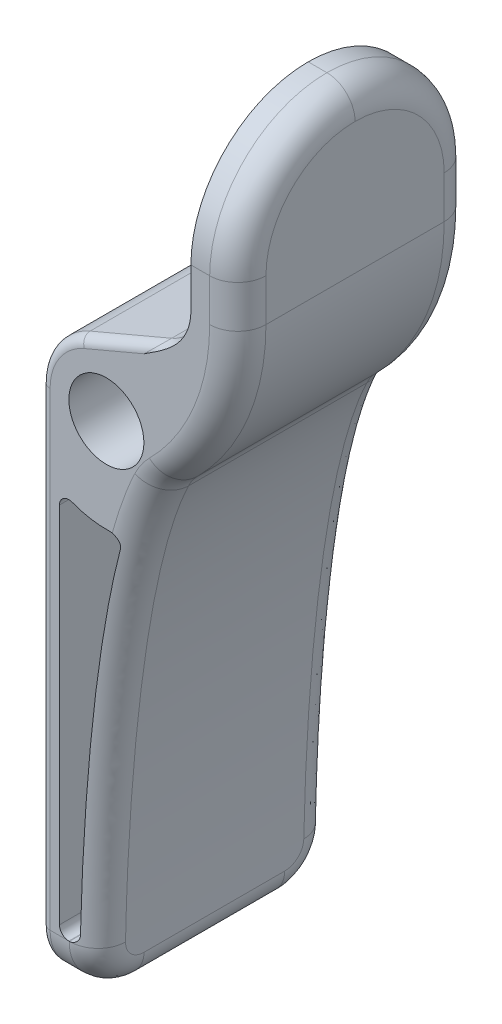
SolidWorks part; units mm, degrees
ref_plane "Front Plane" through (0, 0, 0) normal (0, 0, 1) x (1, 0, 0)
ref_plane "Top Plane" through (0, 0, 0) normal (0, 1, 0) x (1, 0, 0)
ref_plane "Right Plane" through (0, 0, 0) normal (1, 0, 0) x (0, 0, -1)
sketch "Sketch1" plane through (0, 0, 0) normal (0, 0, 1) x (1, 0, 0)
  line L0 (-10.989, -13.3266) -> (-22.7311, -18.3022)
  line L4 (-10.989, -5) -> (-10.989, 5)
  line L5 (-10.989, -13.3266) -> (-10.989, 6.6734)
  line L6 (-5.989, 6.6734) -> (-5.989, -20.9421)
  line L7 (-5.989, -20.9421) -> (-13.8327, -28.5221)
  line L8 (-27, -24.7474) -> (-27, -79.7474)
  line L9 (-27, -79.7474) -> (-21, -79.7474)
  line L11 (-10.989, 6.6734) -> (-5.989, 6.6734)
  circle A0 centre (-20, -24.7474) radius 4 construction
  circle A1 centre (-20, -24.7474) radius 4
  arc A2 (-22.7311, -18.3022) -> (-27, -24.7474) centre (-20, -24.7474) ccw
  circle A4 centre (-20, -24.7474) radius 7 construction
  spline S0 degree 3 poles (-13.8327, -28.5221) (-19.4669, -39.1393) (-21, -66.2952) (-21, -79.1069) (-21, -79.7474) knots 0 0 0 0 0.95 1 1 1 1
  dimension "D2" = 1
  dimension "D3" = 5
  dimension "D4" = 6
  dimension "D5" = 20
  dimension "D6" = 55
  dimension "D1" = 3
extrude "Boss-Extrude1" add sketch "Sketch1" along normal mid plane 25
fillet "Fillet1" radius 25 1 edges at (-5.989, -20.9421, 0)
fillet "Fillet2" radius 5 2 edges at (-24, -79.7474, -12.5) (-24, -79.7474, 12.5)
sketch "Sketch3" plane through (0, 0, 12.5) normal (0, 0, 1) x (1, 0, 0)
  line L9 (-22.9568, -74.7474) -> (-25, -74.7474)
  line L11 (-25, -72.7474) -> (-22.9088, -72.7474)
  line L12 (-25, -24.7474) -> (-25, -72.7474)
  line L14 (-25, -33.4077) -> (-25, -74.7474)
  line L15 (-27, -74.7474) -> (-20.9564, -74.7474) construction
  circle A2 centre (-20, -24.7474) radius 10
  arc A3 (-25, -33.4077) -> (-18.2908, -34.6003) centre (-20, -24.7474) ccw
  spline S4 degree 3 poles (-199.8406, 2921.7791) (28.8401, -299.1007) (-33.6752, -142.6279) (-20.5193, -44.6369) (-19.8168, -40.6145) (-18.4807, -35.1853) (-17.9881, -33.4761) (5.1908, 33.0781) (122.8151, -124.6407) (1906.2672, -2330.1251) knots -5.160033 -5.160033 -5.160033 -5.160033 0.5 0.5 0.75 0.75 0.875 0.875 6.022332 6.022332 6.022332 6.022332 only from (-22.9088, -72.7474) to (-15.5994, -27.5846)
  spline S5 degree 3 poles (-22.9568, -74.7474) (-22.8147, -67.6028) (-22.2995, -57.897) (-20.5193, -44.6369) (-19.8168, -40.6145) (-18.7243, -36.1752) (-18.5129, -35.376) (-18.2908, -34.6003) knots -0.049743 -0.049743 -0.049743 -0.049743 0.5 0.5 0.75 0.75 0.806627 0.806627 0.806627 0.806627
  dimension "D1" = 2
  dimension "D2" = 5
extrude "Cut-Extrude2" cut sketch "Sketch3" against normal up to next
fillet "Fillet6" radius 1 13 edges at (-16.86, -15.8144, -12.5) (-25.836, -20.8821, -12.5) (-16.86, -15.8144, 12.5) (-25.836, -20.8821, 12.5) (-27, -49.7474, 12.5) (-27, -78.283, 11.0355) (-27, -79.7474, 0) (-27, -78.283, -11.0355) (-25, -74.7474, 0) (-25, -33.4077, 0) (-27, -49.7474, -12.5)
fillet "Fillet8" radius 5 3 edges at (-10.989, -13.6447, 12.2071) (-10.989, -13.6447, -12.2071) (-10.989, -13.3266, 0)
fillet "Fillet9" radius 5 1 edges at (-13.8327, -28.5221, 0)
fillet "Fillet10" radius 12.5 2 edges at (-8.489, 6.6734, -12.5) (-8.489, 6.6734, 12.5)
fillet "Fillet11" radius 3 13 edges at (-5.989, 3.0122, -8.8388) (-5.989, -8.081, -12.5) (-7.8844, -19.8842, -12.5) (-20.9993, -78.6518, -10.6235) (-21, -79.7474, 0) (-20.9966, -77.8705, 11.4047) (-7.8844, -19.8842, 12.5) (-5.989, -8.081, 12.5) (-5.989, 3.0122, 8.8388) (-13.8279, -28.6328, -12.5) (-13.8279, -28.6328, 12.5)
